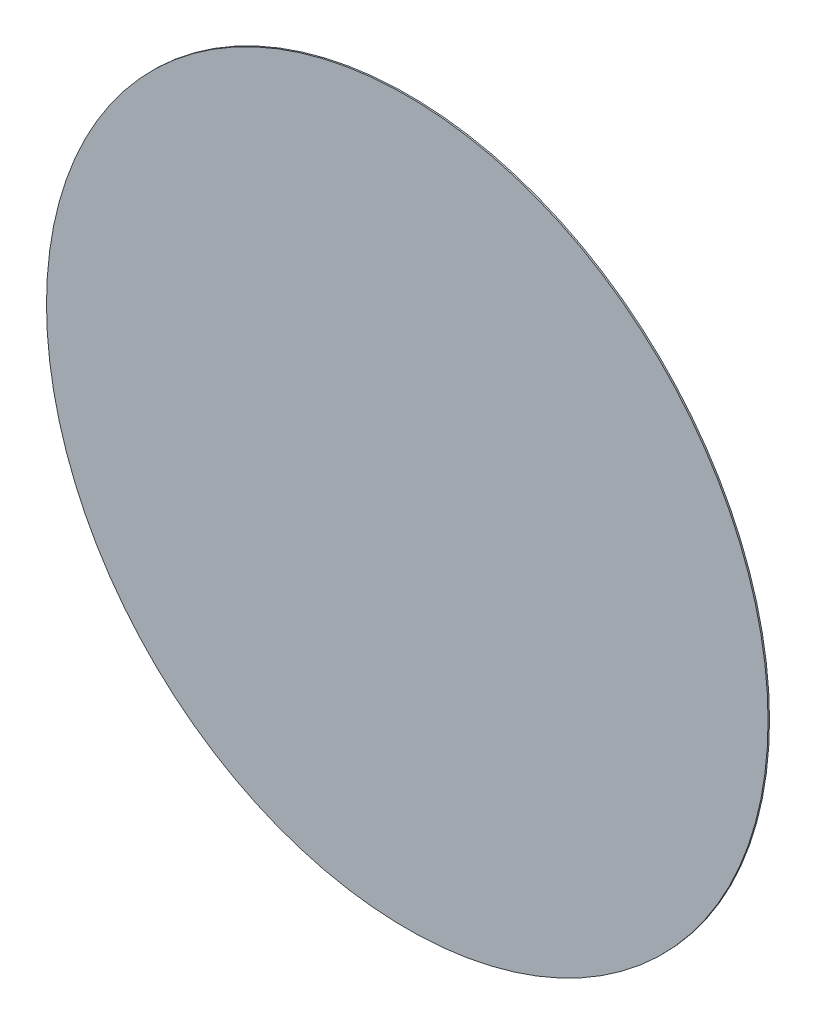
SolidWorks part; units mm, degrees
ref_plane "Front" through (0, 0, 0) normal (0, 0, 1) x (1, 0, 0)
ref_plane "Top" through (0, 0, 0) normal (0, 1, 0) x (1, 0, 0)
ref_plane "Right" through (0, 0, 0) normal (1, 0, 0) x (0, 0, -1)
sketch "Sketch1" plane through (0, 0, 0) normal (0, 0, 1) x (1, 0, 0)
  circle A0 centre (0, 0) radius 12.5
  dimension "D1" = 25
extrude "Extrude1" add sketch "Sketch1" along normal blind 0.05
